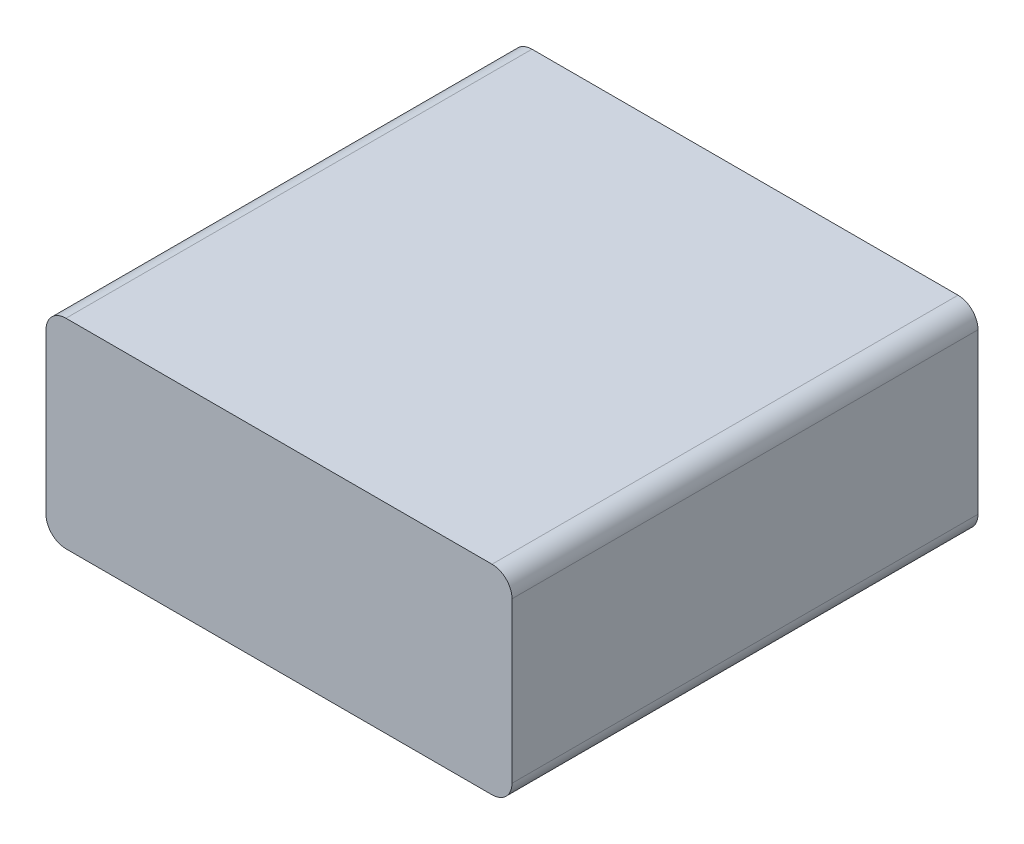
SolidWorks part; units mm, degrees
ref_plane "Front Plane" through (0, 0, 0) normal (0, 0, 1) x (1, 0, 0)
ref_plane "Top Plane" through (0, 0, 0) normal (0, 1, 0) x (1, 0, 0)
ref_plane "Right Plane" through (0, 0, 0) normal (1, 0, 0) x (0, 0, -1)
sketch "Sketch1" plane through (0, 0, 0) normal (0, 1, 0) x (1, 0, 0)
  line L0 (0, 0) -> (38.7913, 0) construction
  line L1 (0, 0) -> (0, 26.4537) construction
  line L3 (-43.2249, 44.45) -> (45.6751, 44.45)
  line L4 (-43.2249, 44.45) -> (-43.2249, -44.45)
  line L5 (-43.2249, -44.45) -> (45.6751, -44.45)
  line L6 (45.6751, 44.45) -> (45.6751, -44.45)
  dimension "D1" = 88.9
  dimension "D2" = 88.9
  dimension "D3" = 44.45
extrude "Boss-Extrude1" add sketch "Sketch1" along normal blind 38.1
fillet "Fillet1" radius 3.81 4 edges at (-43.2249, 0, 0) (-43.2249, 38.1, 0) (45.6751, 0, 0) (45.6751, 38.1, 0)
